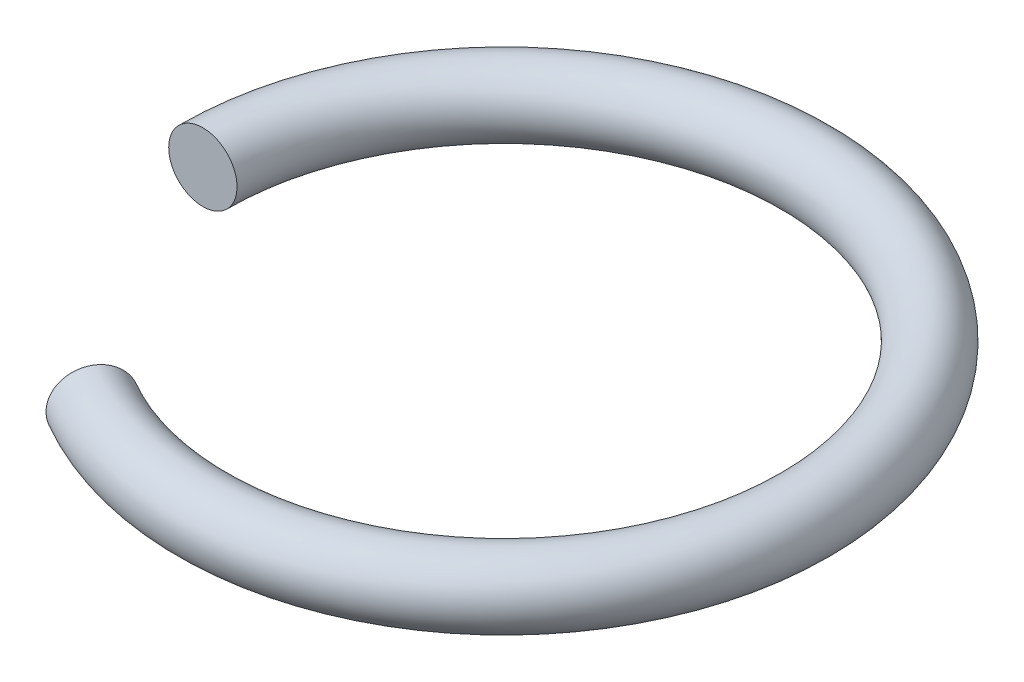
SolidWorks part; units mm, degrees
ref_plane "Face" through (0, 0, 0) normal (0, 0, 1) x (1, 0, 0)
ref_plane "Dessus" through (0, 0, 0) normal (0, 1, 0) x (1, 0, 0)
ref_plane "Droite" through (0, 0, 0) normal (1, 0, 0) x (0, 0, -1)
sketch "Esquisse1" plane through (0, 0, 0) normal (0, 0, 1) x (1, 0, 0)
  line L0 (8.05, -19.3) -> (-8.05, -19.3) construction
  line L1 (0, 0) -> (0, -19) construction
  circle A0 centre (-6.83, -18.525) radius 0.775
  dimension "D1" = 1.55
  dimension "D2" = 6.83
revolve "Révolution1" add sketch "Esquisse1" angle 300 about L1
